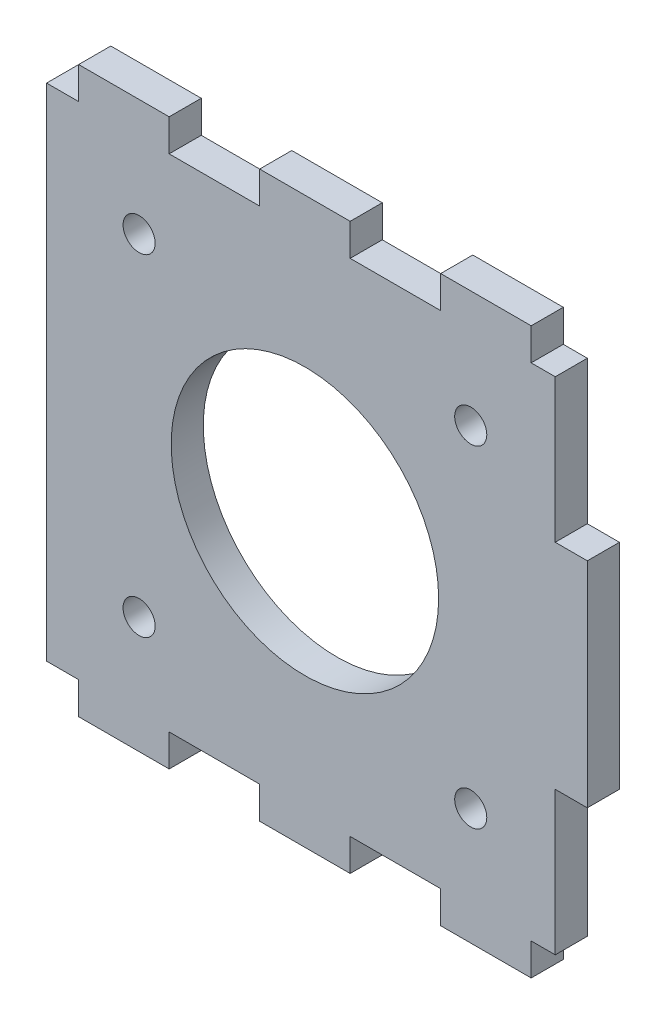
SolidWorks part; units mm, degrees
ref_plane "Front Plane" through (0, 0, 0) normal (0, 0, 1) x (1, 0, 0)
ref_plane "Top Plane" through (0, 0, 0) normal (0, 1, 0) x (1, 0, 0)
ref_plane "Right Plane" through (0, 0, 0) normal (1, 0, 0) x (0, 0, -1)
sketch "Sketch1" plane through (0, 0, 0) normal (0, 0, 1) x (1, 0, 0)
  line L0 (11.565, -23.4) -> (20.025, -23.4)
  line L1 (20.025, -23.4) -> (20.025, -26.4)
  line L2 (20.025, -26.4) -> (11.565, -26.4)
  line L3 (11.565, -26.4) -> (11.565, -23.4)
  line L4 (-5.355, -23.4) -> (3.105, -23.4)
  line L5 (3.105, -23.4) -> (3.105, -26.4)
  line L6 (3.105, -26.4) -> (-5.355, -26.4)
  line L7 (-5.355, -26.4) -> (-5.355, -23.4)
  line L8 (-22.275, -23.4) -> (-13.815, -23.4)
  line L9 (-13.815, -23.4) -> (-13.815, -26.4)
  line L10 (-13.815, -26.4) -> (-22.275, -26.4)
  line L11 (-22.275, -26.4) -> (-22.275, -23.4)
  line L12 (-22.275, 26.4) -> (-13.815, 26.4)
  line L13 (-13.815, 26.4) -> (-13.815, 23.4)
  line L14 (-13.815, 23.4) -> (-22.275, 23.4)
  line L15 (-22.275, 23.4) -> (-22.275, 26.4)
  line L16 (-5.355, 26.4) -> (3.105, 26.4)
  line L17 (3.105, 26.4) -> (3.105, 23.4)
  line L18 (3.105, 23.4) -> (-5.355, 23.4)
  line L19 (-5.355, 23.4) -> (-5.355, 26.4)
  line L20 (11.565, 26.4) -> (20.025, 26.4)
  line L21 (20.025, 26.4) -> (20.025, 23.4)
  line L22 (20.025, 23.4) -> (11.565, 23.4)
  line L23 (11.565, 23.4) -> (11.565, 26.4)
  line L24 (22.275, 10) -> (25.275, 10)
  line L25 (25.275, 10) -> (25.275, -10)
  line L26 (25.275, -10) -> (22.275, -10)
  line L27 (22.275, -10) -> (22.275, 10)
  line L28 (22.275, 23.4) -> (-25.275, 23.4)
  line L29 (22.275, 23.4) -> (22.275, -23.4)
  line L30 (22.275, -23.4) -> (-25.275, -23.4)
  line L31 (-25.275, 23.4) -> (-25.275, -23.4)
  circle A0 centre (-1.125, 0) radius 12.5
  circle A1 centre (14.375, 15.5) radius 1.5
  circle A2 centre (14.375, -15.5) radius 1.5
  circle A3 centre (-16.625, -15.5) radius 1.5
  circle A4 centre (-16.625, 15.5) radius 1.5
  dimension "D1" = 25
  dimension "D2" = 3
extrude "Boss-Extrude1" add sketch "Sketch1" along normal blind 3 contours L28 L31 L30 L8 L4 L0 L29 L27 L22 L18 L14 A4 A3 A2 A1 A0 | L23 L22 L21 L20 | L19 L18 L17 L16 | L15 L14 L13 L12 | L27 L26 L25 L24 | L3 L2 L1 L0 | L7 L6 L5 L4 | L11 L10 L9 L8
